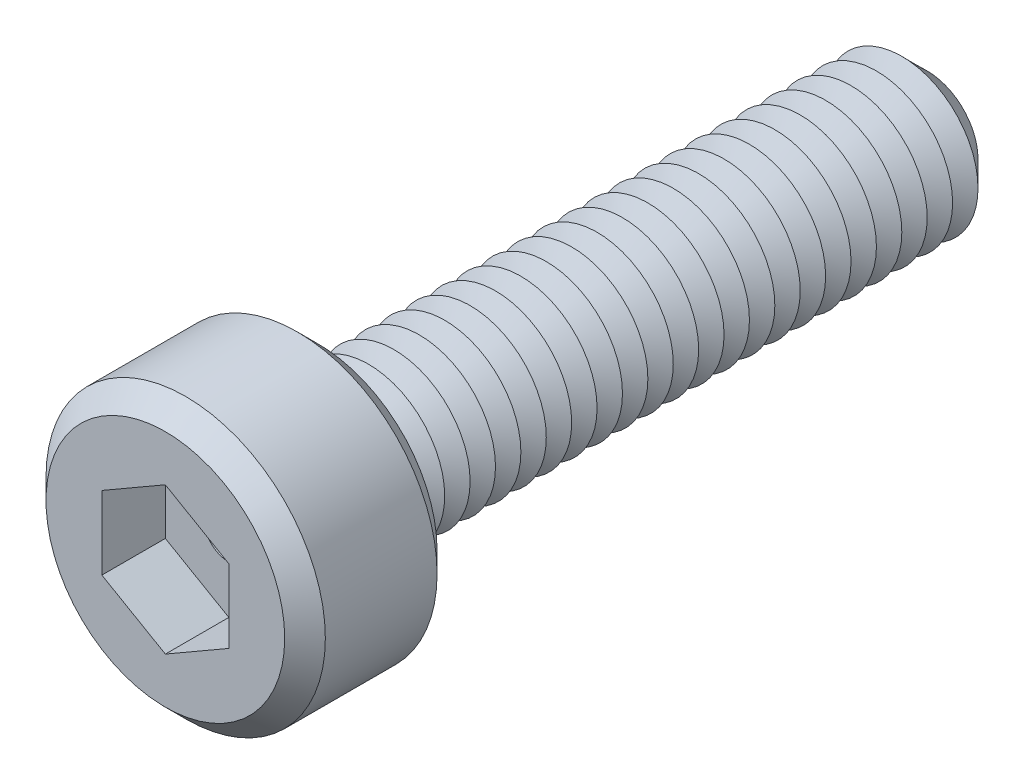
SolidWorks part; units mm, degrees
ref_plane "Front Plane" through (0, 0, 0) normal (0, 0, 1) x (1, 0, 0)
ref_plane "Top Plane" through (0, 0, 0) normal (0, 1, 0) x (1, 0, 0)
ref_plane "Right Plane" through (0, 0, 0) normal (1, 0, 0) x (0, 0, -1)
sketch "Sketch1" plane through (0, 0, 0) normal (0, 0, 1) x (1, 0, 0)
  circle A0 centre (0, 0) radius 2.75
  dimension "D1" = 5.5
extrude "Boss-Extrude1" add sketch "Sketch1" along normal blind 3
sketch "Sketch2" plane through (0, 0, 0) normal (0, 0, -1) x (-1, 0, 0)
  circle A0 centre (0, 0) radius 1.5
  dimension "D1" = 3
extrude "Boss-Extrude2" add sketch "Sketch2" along normal blind 12
chamfer "Chamfer1" distance 0.5 angle 45 1 edges at (-1.5, 0, -12)
sketch "Sketch3" plane through (0, 0, 0) normal (1, 0, 0) x (0, 0, -1)
  line L0 (-2.5121, 0) -> (4.5776, 0) construction
sketch "Sketch4" plane through (0, 0, 0) normal (1, 0, 0) x (0, 0, -1)
  line L0 (0, 1.5) -> (0.25, 1.067)
  line L1 (0.25, 1.067) -> (0.5, 1.5)
  line L2 (11.5, 1.5) -> (0, 1.5) construction
  line L3 (0.5, 1.5) -> (0, 1.5)
  dimension "D1" = 0.5
revolve "Cut-Revolve1" cut sketch "Sketch4" angle 360 about L0
pattern_linear "LPattern1" count 23 spacing 0.5 along (0, 0, -1) of "Cut-Revolve1"
sketch "Sketch5" plane through (0, 0, 3) normal (0, 0, 1) x (1, 0, 0)
  line L1 (0, 1.4434) -> (-1.25, 0.7217)
  line L2 (-1.25, 0.7217) -> (-1.25, -0.7217)
  line L3 (-1.25, -0.7217) -> (0, -1.4434)
  line L4 (0, -1.4434) -> (1.25, -0.7217)
  line L5 (1.25, -0.7217) -> (1.25, 0.7217)
  line L6 (1.25, 0.7217) -> (0, 1.4434)
  circle A0 centre (0, 0) radius 1.25 construction
  dimension "D1" = 2.5
extrude "Cut-Extrude1" cut sketch "Sketch5" against normal blind 1.25
sketch "Sketch6" plane through (0, 0, 1.75) normal (0, 0, 1) x (1, 0, 0)
  circle A0 centre (0, 0) radius 0.5
  dimension "D1" = 1
extrude "Cut-Extrude2" cut sketch "Sketch6" against normal up to surface (13.75 mm away)
chamfer "Chamfer2" distance 0.4 angle 45 2 edges at (2.75, 0, 0) (2.75, 0, 3)
